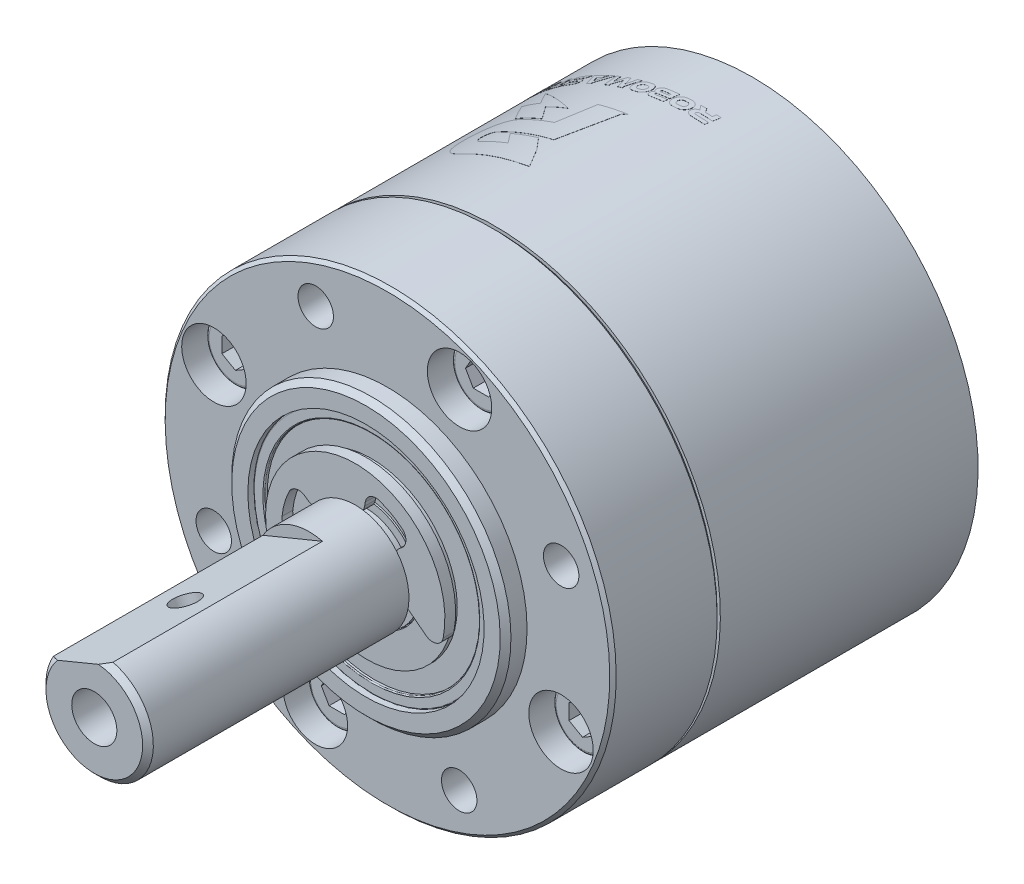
SolidWorks part; units mm, degrees
ref_plane "前视基准面" through (0, 0, 0) normal (0, 0, 1) x (1, 0, 0)
ref_plane "上视基准面" through (0, 0, 0) normal (0, 1, 0) x (1, 0, 0)
ref_plane "右视基准面" through (0, 0, 0) normal (1, 0, 0) x (0, 0, -1)
imported_body "YC.WJ.ZZ000038.01 WS2017 M3508减速电机 减速箱V1-1/WS2017 M3508 19-1减速箱-1-solid1"
imported_body "YC.WJ.ZZ000038.01 WS2017 M3508减速电机 减速箱V1-1/1025-0001 上盖板-1-solid1"
imported_body "YC.WJ.ZZ000038.01 WS2017 M3508减速电机 减速箱V1-1/卡簧-1-solid1"
imported_body "YC.WJ.ZZ000038.01 WS2017 M3508减速电机 减速箱V1-1/轴承22-10-6-1/轴承22-10-6-1-solid1"
imported_body "YC.WJ.ZZ000038.01 WS2017 M3508减速电机 减速箱V1-1/轴承22-10-6-1/轴承22-10-6挡片-1-solid1"
imported_body "YC.WJ.ZZ000038.01 WS2017 M3508减速电机 减速箱V1-1/轴承22-10-6-1/轴承22-10-6挡片-2-solid1"
imported_body "YC.WJ.ZZ000038.01 WS2017 M3508减速电机 减速箱V1-1/轴承22-10-6-2/轴承22-10-6-1-solid1"
imported_body "YC.WJ.ZZ000038.01 WS2017 M3508减速电机 减速箱V1-1/轴承22-10-6-2/轴承22-10-6挡片-1-solid1"
imported_body "YC.WJ.ZZ000038.01 WS2017 M3508减速电机 减速箱V1-1/轴承22-10-6-2/轴承22-10-6挡片-2-solid1"
imported_body "YC.WJ.ZZ000038.01 WS2017 M3508减速电机 减速箱V1-1/1025-0045输出轴（大疆）-1-solid1"
imported_body "YC.WJ.ZZ000038.01 WS2017 M3508减速电机 减速箱V1-1/垫圈-1-solid1"
imported_body "YC.WJ.ZZ000038.01 WS2017 M3508减速电机 减速箱V1-1/M3螺钉-1-solid1"
imported_body "YC.WJ.ZZ000038.01 WS2017 M3508减速电机 减速箱V1-1/M3螺钉-2-solid1"
imported_body "YC.WJ.ZZ000038.01 WS2017 M3508减速电机 减速箱V1-1/M3螺钉-3-solid1"
imported_body "YC.WJ.ZZ000038.01 WS2017 M3508减速电机 减速箱V1-1/M3螺钉-4-solid1"
imported_body "RM3510减速电机垫片-1-solid1"
imported_body "WS2017 C620三相动力线组件-1/MR30 3D M-1-surface1" [suppressed]
imported_body "WS2017 C620三相动力线组件-1/MR30 3D M-1-surface2" [suppressed]
imported_body "WS2017 C620三相动力线组件-1/MR30 3D M-1-surface3" [suppressed]
imported_body "WS2017 C620三相动力线组件-1/MR30 3D M-1-surface4" [suppressed]
imported_body "WS2017 C620三相动力线组件-1/MR30 3D M-1-surface5" [suppressed]
imported_body "WS2017 C620三相动力线组件-1/MR30 3D M-1-surface6" [suppressed]
imported_body "WS2017 C620三相动力线组件-1/MR30 3D M-1-surface7" [suppressed]
imported_body "WS2017 C620三相动力线组件-1/MR30 3D M-1-surface8" [suppressed]
imported_body "WS2017 C620三相动力线组件-1/MR30 3D M-1-surface9" [suppressed]
imported_body "WS2017 C620三相动力线组件-1/MR30 3D M-1-surface10" [suppressed]
imported_body "WS2017 C620三相动力线组件-1/MR30 3D M-1-surface11" [suppressed]
imported_body "WS2017 C620三相动力线组件-1/MR30 3D M-1-surface12" [suppressed]
imported_body "WS2017 C620三相动力线组件-1/MR30 3D M-1-surface13" [suppressed]
imported_body "WS2017 C620三相动力线组件-1/MR30 3D M-1-surface14" [suppressed]
imported_body "WS2017 C620三相动力线组件-1/MR30 3D M-1-surface15" [suppressed]
imported_body "WS2017 C620三相动力线组件-1/MR30 3D M-1-surface16" [suppressed]
imported_body "WS2017 C620三相动力线组件-1/YC.XC.DD000004.01 WS2017 M3508 耐高温硅胶线（黑色）_动力线V1-1-solid1" [suppressed]
imported_body "WS2017 C620三相动力线组件-1/YC.XC.DD000004.01 WS2017 M3508 耐高温硅胶线（黑色）_动力线V1-2-solid1" [suppressed]
imported_body "WS2017 C620三相动力线组件-1/YC.XC.DD000004.01 WS2017 M3508 耐高温硅胶线（黑色）_动力线V1-3-solid1" [suppressed]
imported_body "WS2017 C620三相动力线组件-1/MR30 3D 护套-1-surface1" [suppressed]
sketch "草图1"
sketch_block_instance "块1-1"
sketch_block "块1"
sketch "Sketch1" plane through (0, 0, 50.441) normal (0, 0, -1) x (-1, 0, 0)
  line L1 (-31.8118, 44.5684) -> (35.3893, 44.5684)
  line L2 (-31.8118, 44.5684) -> (-31.8118, -8.0318)
  line L3 (-31.8118, -8.0318) -> (35.3893, -8.0318)
  line L4 (35.3893, 44.5684) -> (35.3893, -8.0318)
  line L5 (-31.8118, 44.5684) -> (35.3893, -8.0318) construction
  line L6 (-31.8118, -8.0318) -> (35.3893, 44.5684) construction
  point P0 (1.7887, 18.2683)
extrude "Cut-Extrude1" cut sketch "Sketch1" against normal blind 2
